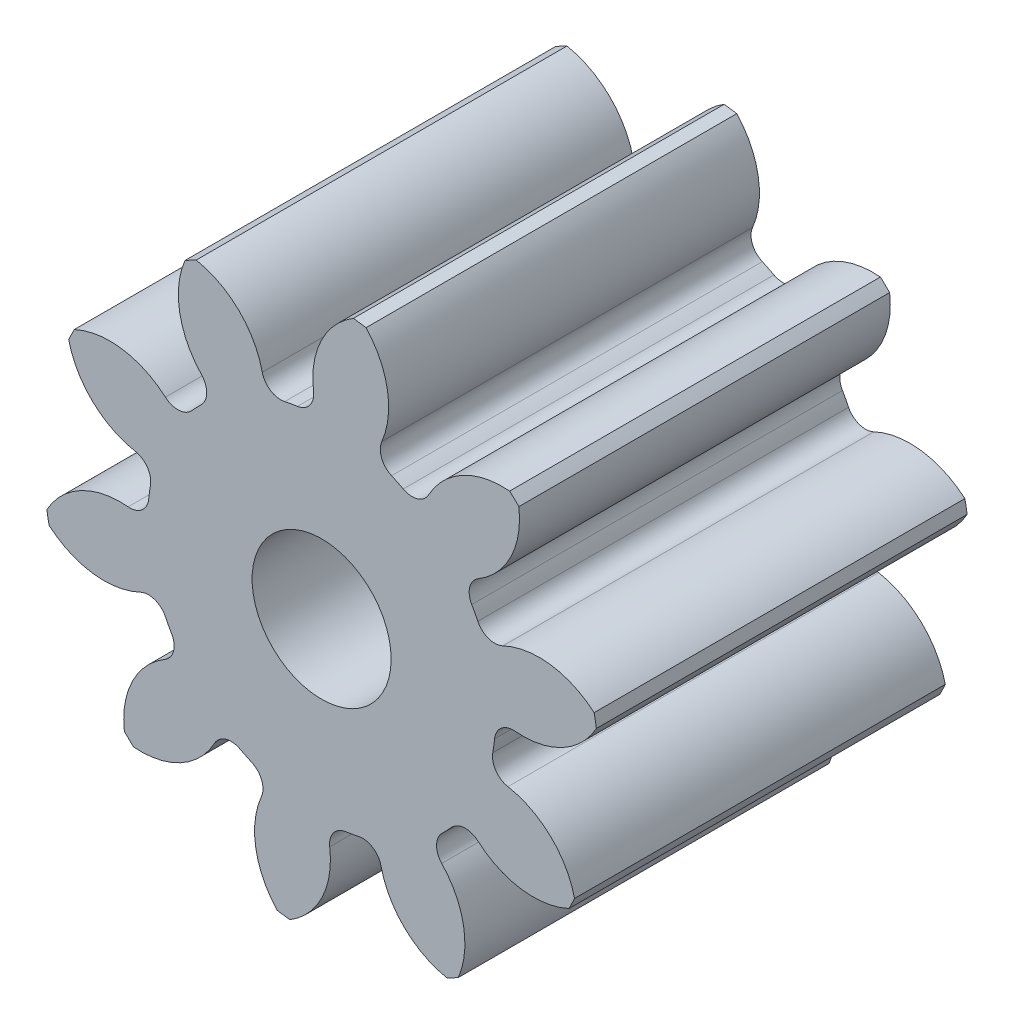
SolidWorks part; units mm, degrees
ref_plane "Front" through (0, 0, 0) normal (0, 0, 1) x (1, 0, 0)
ref_plane "Top" through (0, 0, 0) normal (0, 1, 0) x (1, 0, 0)
ref_plane "Right" through (0, 0, 0) normal (1, 0, 0) x (0, 0, -1)
sketch "Sketch3" plane through (0, 0, 0) normal (0, 0, 1) x (1, 0, 0)
  circle A0 centre (0, 0) radius 76.2
  dimension "od" = 152.4
extrude "gearBody" add sketch "Sketch3" along normal blind 101.6
sketch "Sketch2" plane through (0, 0, 0) normal (0, 0, 1) x (1, 0, 0)
  line L0 (0, 0) -> (55.1283, 22.8349) construction
  line L1 (69.6868, -33.6451) -> (0, 0) construction
  line L2 (0, 0) -> (36.3143, 0) construction
  line L3 (63.4857, 1.3495) -> (60.74, -18.5176) construction
  line L5 (62.1128, -8.584) -> (0, 0) construction
  line L7 (0, 0) -> (59.6705, 0) construction
  arc A0 (59.67, 0.2332) -> (57.3702, -16.4082) centre (0, 0) ccw construction
  arc A1 (75.3004, 11.6745) -> (69.3115, -31.66) centre (0, 0) ccw construction
  arc A2 (63.4857, 1.3495) -> (60.74, -18.5176) centre (0, 0) ccw construction
  arc A3 (46.8999, -8.2786) -> (47.3873, -4.752) centre (0, 0) ccw
  arc A4 (69.6868, -33.6451) -> (51.0522, -14.2602) centre (46.8686, -36.931) ccw
  arc A5 (69.6868, -33.6451) -> (76.2, 13.4834) centre (0, 0) ccw
  arc A6 (76.2, 13.4834) -> (53.0062, -0.1208) centre (55.1283, 22.8349) cw
  arc A7 (47.3873, -4.752) -> (53.0062, -0.1208) centre (52.5304, -5.2677) cw
  arc A8 (51.0522, -14.2602) -> (46.8999, -8.2786) centre (51.9902, -9.1771) cw
  point P6 (76.2, 13.4834)
  point P22 (69.6868, -33.6451)
  dimension "baseDia" = 119.341
  dimension "od" = 152.4
  dimension "pd" = 127
  dimension "rd" = 95.25
  dimension "rFillet" = 5.1689
  dimension "pointX" = 76.2
  dimension "pointY" = 13.4834
  dimension "CTT" = 19.8672
  dimension "flankCenterAngle" = 22.5
extrude "toothCut" cut sketch "Sketch2" along normal through all
pattern_circular "CirPattern1" count 10 over 360 about axis through (0, 0, 0) along (0, 0, 1) of "toothCut"
sketch "hub1Dia" plane through (0, 0, 0) normal (0, 0, -1) x (-1, 0, 0)
  circle A0 centre (0, 0) radius 12.7
  dimension "hub1Dia" = 25.4
sketch "hub2Dia" plane through (0, 0, 101.6) normal (0, 0, 1) x (1, 0, 0)
  circle A0 centre (0, 0) radius 12.7
  dimension "hub2dia" = 25.4
sketch "boreDia" plane through (0, 0, 0) normal (0, 0, 1) x (1, 0, 0)
  circle A0 centre (0, 0) radius 19.05
  dimension "boreDia" = 38.1
extrude "bore" cut sketch "boreDia" against normal mid plane 25400
